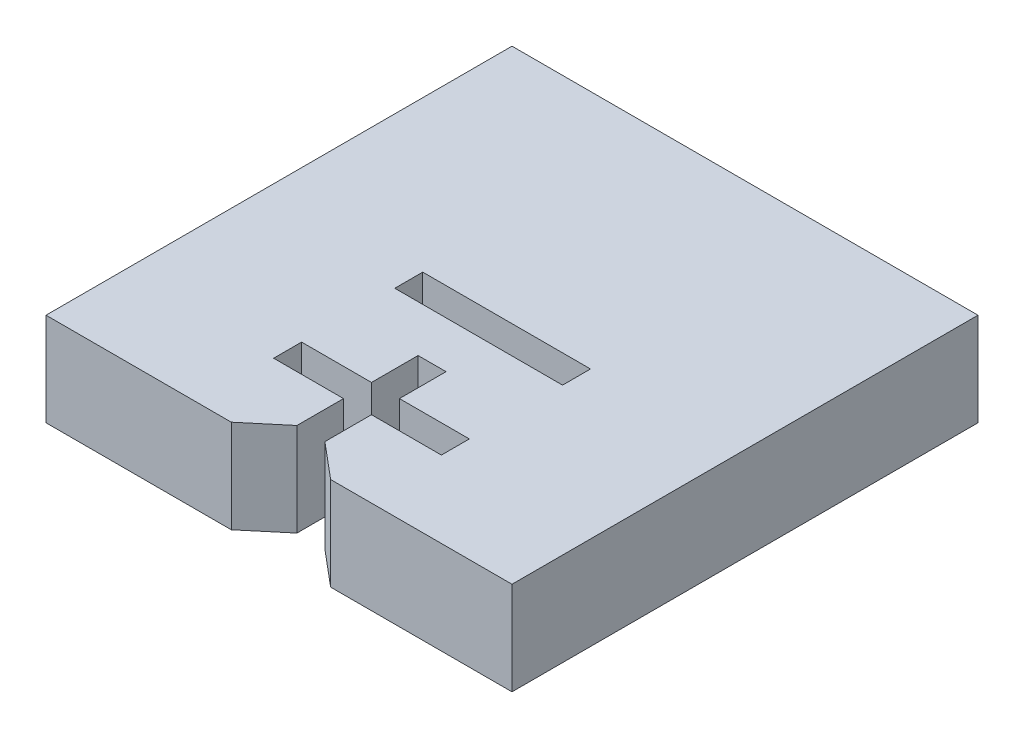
SolidWorks part; units mm, degrees
ref_plane "Front Plane" through (0, 0, 0) normal (0, 0, 1) x (1, 0, 0)
ref_plane "Top Plane" through (0, 0, 0) normal (0, 1, 0) x (1, 0, 0)
ref_plane "Right Plane" through (0, 0, 0) normal (1, 0, 0) x (0, 0, -1)
sketch "Sketch1" plane through (0, 0, 0) normal (0, 1, 0) x (1, 0, 0)
  line L0 (-11.1194, 28.8537) -> (-6.4209, 27.1436)
  line L1 (-3.4209, 16.8936) -> (-3.4209, 11.8936)
  line L2 (-30.9989, 28.8537) -> (-30.9989, -21.1463)
  line L3 (-30.9989, -21.1463) -> (19.0011, -21.1463)
  line L4 (19.0011, 28.8537) -> (19.0011, -21.1463)
  line L5 (-6.4209, 27.1436) -> (-6.4209, 21.1436)
  line L6 (-6.4209, 21.1436) -> (-13.9209, 21.1436)
  line L7 (-13.9209, 21.1436) -> (-13.9209, 17.8936)
  line L8 (-13.9209, 17.8936) -> (-6.4209, 17.8936)
  line L9 (-6.4209, 17.8936) -> (-6.4209, 11.8936)
  line L10 (-0.4589, 54.5837) -> (-11.1194, 54.5837)
  line L11 (3.2108, 16.8936) -> (-3.4209, 16.8936)
  line L12 (3.2108, 22.1436) -> (3.2108, 16.8936)
  line L13 (-3.1709, 22.1436) -> (3.2108, 22.1436)
  line L14 (-3.1709, 27.1436) -> (-3.1709, 22.1436)
  line L15 (1.5275, 28.8537) -> (-3.1709, 27.1436)
  line L16 (-30.9989, 28.8537) -> (-11.1194, 28.8537)
  line L17 (1.5275, 28.8537) -> (19.0011, 28.8537)
  line L18 (-6.4209, 11.8936) -> (-3.4209, 11.8936)
  line L19 (-3.4209, 11.8936) -> (-3.6194, 11.9716)
  line L20 (3.2108, 75.7976) -> (3.2108, 78.7976)
  line L21 (-13.9209, 5.8936) -> (3.2108, 5.8936)
  line L22 (-13.9209, 5.8936) -> (-13.9209, 2.6436)
  line L23 (-13.9209, 2.6436) -> (3.2108, 2.6436)
  line L24 (3.2108, 5.8936) -> (3.2108, 2.6436)
  line L25 (-14.7892, 78.7976) -> (3.2108, 78.7976)
  line L26 (-14.7892, 75.7976) -> (-14.7892, 78.7976)
  line L27 (-14.7892, 75.7976) -> (3.2108, 75.7976)
  line L28 (-4.2892, 70.7976) -> (-4.4877, 70.7196)
  line L29 (-7.2892, 70.7976) -> (-4.2892, 70.7976)
  line L30 (-0.4589, 54.5837) -> (19.0011, 54.5837)
  line L31 (-30.9989, 54.5837) -> (-11.1194, 54.5837)
  line L32 (-0.4589, 54.5837) -> (-4.2892, 57.7976)
  line L33 (-4.2892, 57.7976) -> (-4.2892, 62.7976)
  line L34 (-4.2892, 62.7976) -> (3.2108, 62.7976)
  line L35 (3.2108, 62.7976) -> (3.2108, 65.7976)
  line L36 (3.2108, 65.7976) -> (-4.2892, 65.7976)
  line L37 (-7.2892, 65.7976) -> (-7.2892, 70.7976)
  line L38 (-14.7892, 65.7976) -> (-7.2892, 65.7976)
  line L39 (-14.7892, 62.7976) -> (-14.7892, 65.7976)
  line L40 (-7.2892, 62.7976) -> (-14.7892, 62.7976)
  line L41 (-7.2892, 57.7976) -> (-7.2892, 62.7976)
  line L42 (19.0011, 54.5837) -> (19.0011, 104.5837)
  line L43 (-30.9989, 104.5837) -> (19.0011, 104.5837)
  line L44 (-30.9989, 54.5837) -> (-30.9989, 104.5837)
  line L45 (-4.2892, 65.7976) -> (-4.2892, 70.7976)
  line L46 (-11.1194, 54.5837) -> (-7.2892, 57.7976)
  dimension "D1" = 50
  dimension "D2" = 50
  dimension "D3" = 110
  dimension "D5" = 6
  dimension "D7" = 3.25
  dimension "D8" = 7.5
  dimension "D9" = 6
  dimension "D10" = 3.25
  dimension "D11" = 110
  dimension "D12" = 6
  dimension "D13" = 3.25
extrude "Boss-Extrude1" add sketch "Sketch1" along normal blind 10 contours L31 L46 L41 L40 L39 L38 L37 L29 L45 L36 L35 L34 L33 L32 L30 L42 L43 L44 L27 L26 L25 L20
